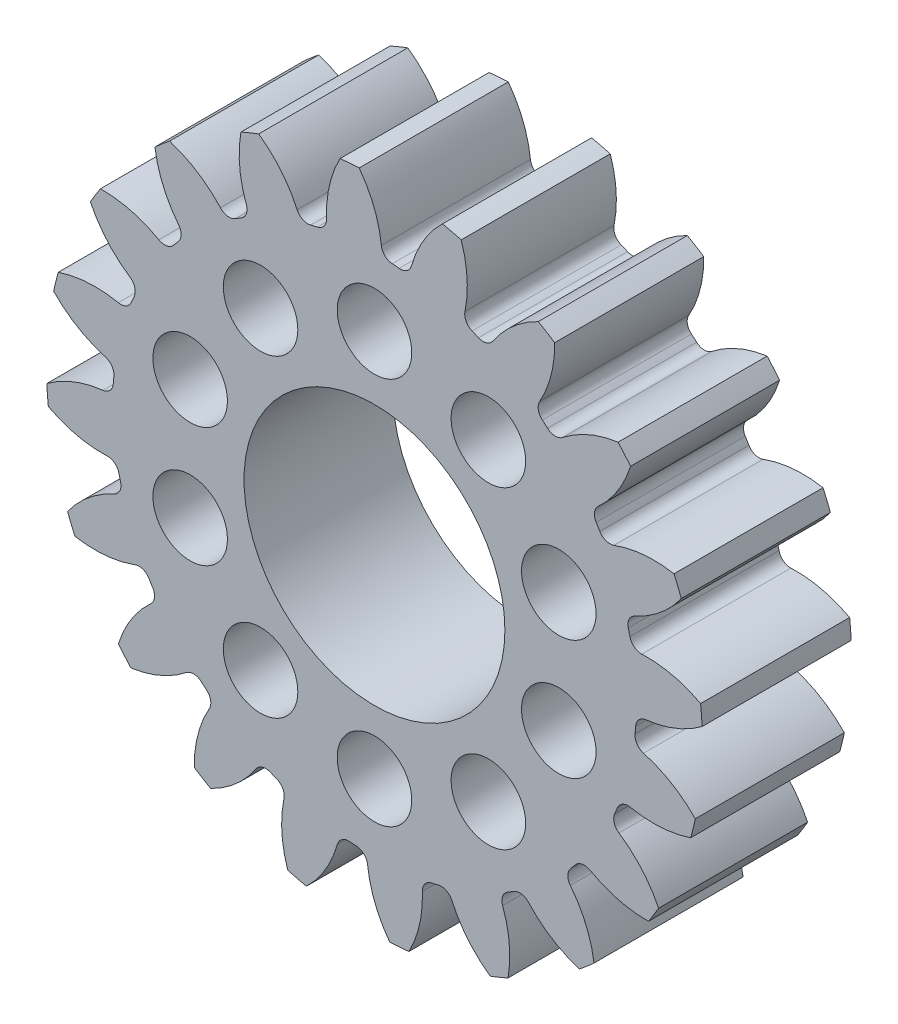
SolidWorks part; units mm, degrees
ref_plane "Front" through (0, 0, 0) normal (0, 0, 1) x (1, 0, 0)
ref_plane "Top" through (0, 0, 0) normal (0, 1, 0) x (1, 0, 0)
ref_plane "Right" through (0, 0, 0) normal (1, 0, 0) x (0, 0, -1)
sketch "Sketch3" plane through (0, 0, 0) normal (0, 0, 1) x (1, 0, 0)
  circle A0 centre (0, 0) radius 27.94
  dimension "od" = 55.88
extrude "gearBody" add sketch "Sketch3" along normal blind 12.7
sketch "Sketch2" plane through (0, 0, 0) normal (0, 0, 1) x (1, 0, 0)
  line L0 (0, 0) -> (22.0513, 9.134) construction
  line L1 (29.1507, -8.4463) -> (0, 0) construction
  line L2 (0, 0) -> (36.3143, 0) construction
  line L3 (25.3999, -0.0573) -> (25.075, -4.0502) construction
  line L5 (25.2375, -2.0538) -> (0, 0) construction
  line L7 (0, 0) -> (23.8682, 0) construction
  arc A0 (23.8634, -0.479) -> (23.6269, -3.3856) centre (0, 0) ccw construction
  arc A1 (27.9097, 1.2999) -> (27.3323, -5.7954) centre (0, 0) ccw construction
  arc A2 (25.3999, -0.0573) -> (25.075, -4.0502) centre (0, 0) ccw construction
  arc A3 (22.2016, -2.1049) -> (22.2499, -1.5125) centre (0, 0) ccw
  arc A4 (29.1507, -8.4463) -> (22.9259, -3.1603) centre (20.2844, -12.5791) ccw
  arc A5 (29.1507, -8.4463) -> (30.1328, 3.6219) centre (0, 0) ccw
  arc A6 (30.1328, 3.6219) -> (23.1352, -0.5881) centre (22.0513, 9.134) cw
  arc A7 (22.2499, -1.5125) -> (23.1352, -0.5881) centre (23.2458, -1.5802) cw
  arc A8 (22.9259, -3.1603) -> (22.2016, -2.1049) centre (23.1954, -2.1991) cw
  point P6 (30.1328, 3.6219)
  point P22 (29.1507, -8.4463)
  dimension "baseDia" = 47.7364
  dimension "od" = 55.88
  dimension "pd" = 50.8
  dimension "rd" = 44.6024
  dimension "rFillet" = 0.9982
  dimension "pointX" = 30.1328
  dimension "pointY" = 3.6219
  dimension "CTT" = 3.9929
  dimension "flankCenterAngle" = 22.5
extrude "toothCut" cut sketch "Sketch2" along normal through all
pattern_circular "CirPattern1" count 20 over 360 about axis through (0, 0, 0) along (0, 0, 1) of "toothCut"
sketch "hub1Dia" plane through (0, 0, 0) normal (0, 0, -1) x (-1, 0, 0)
  circle A0 centre (0, 0) radius 21.844
  dimension "hub1Dia" = 43.688
sketch "hub2Dia" plane through (0, 0, 12.7) normal (0, 0, 1) x (1, 0, 0)
  circle A0 centre (0, 0) radius 21.844
  dimension "hub2dia" = 43.688
extrude "hub2" [suppressed] add sketch "hub2Dia" along normal blind 16.002
sketch "boreDia" plane through (0, 0, 0) normal (0, 0, 1) x (1, 0, 0)
  circle A0 centre (0, 0) radius 11.1125
  dimension "boreDia" = 22.225
extrude "bore" cut sketch "boreDia" against normal mid plane 25400
chamfer "hub2Chamfer" [suppressed] distance 0.508 angle 45
chamfer "hub2BoreChamfer" [suppressed] distance 0.508 angle 45
chamfer "BoreChamfer2" [suppressed] distance 0.508 angle 45
chamfer "boreChamfer1" [suppressed] distance 0.508 angle 45
sketch "Sketch4" plane through (0, 0, 12.7) normal (0, 0, 1) x (1, 0, 0)
  line L0 (0, 0) -> (0, -16.51) construction
  line L1 (0, 0) -> (0, -16.51) construction
  circle A0 centre (0, -16.51) radius 3.175
  circle A2 centre (0, 0) radius 11.1125 construction
  arc A3 (1.2999, -27.9097) -> (2.9344, -27.7855) centre (0, 0) ccw construction
  circle A4 centre (-9.7043, -13.3569) radius 3.175
  circle A5 centre (-15.7019, -5.1019) radius 3.175
  circle A6 centre (-15.7019, 5.1019) radius 3.175
  circle A7 centre (-9.7043, 13.3569) radius 3.175
  circle A8 centre (0, 16.51) radius 3.175
  circle A9 centre (9.7043, 13.3569) radius 3.175
  circle A10 centre (15.7019, 5.1019) radius 3.175
  circle A11 centre (15.7019, -5.1019) radius 3.175
  circle A12 centre (9.7043, -13.3569) radius 3.175
  point P7 (2.1181, -27.8596)
  dimension "D2" = 11.3496
  dimension "D1" = 16.51
  dimension "D4" = 16.51
  dimension "D3" = 10
extrude "Cut-Extrude2" cut sketch "Sketch4" against normal through all
